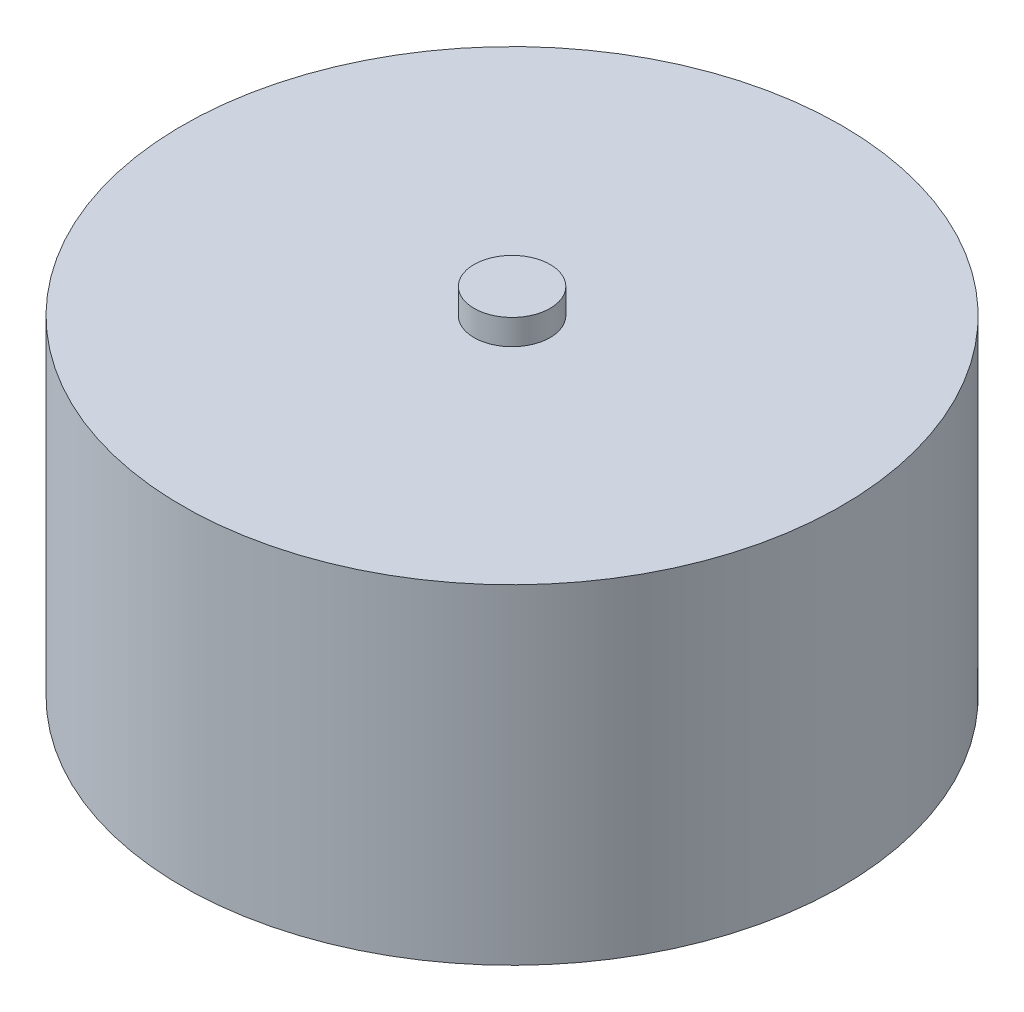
SolidWorks part; units mm, degrees
ref_plane "Front" through (0, 0, 0) normal (0, 0, 1) x (1, 0, 0)
ref_plane "Top" through (0, 0, 0) normal (0, 1, 0) x (1, 0, 0)
ref_plane "Right" through (0, 0, 0) normal (1, 0, 0) x (0, 0, -1)
sketch "Sketch1" plane through (0, 0, 0) normal (0, 1, 0) x (1, 0, 0)
  circle A0 centre (0, 0) radius 6.5
  dimension "D1" = 13
extrude "Boss-Extrude1" add sketch "Sketch1" along normal blind 6.5
sketch "Sketch2" plane through (0, 6.5, 0) normal (0, 1, 0) x (1, 0, 0)
  circle A0 centre (0, 0) radius 0.75
  dimension "D1" = 1.5
extrude "Boss-Extrude2" add sketch "Sketch2" along normal blind 0.5
